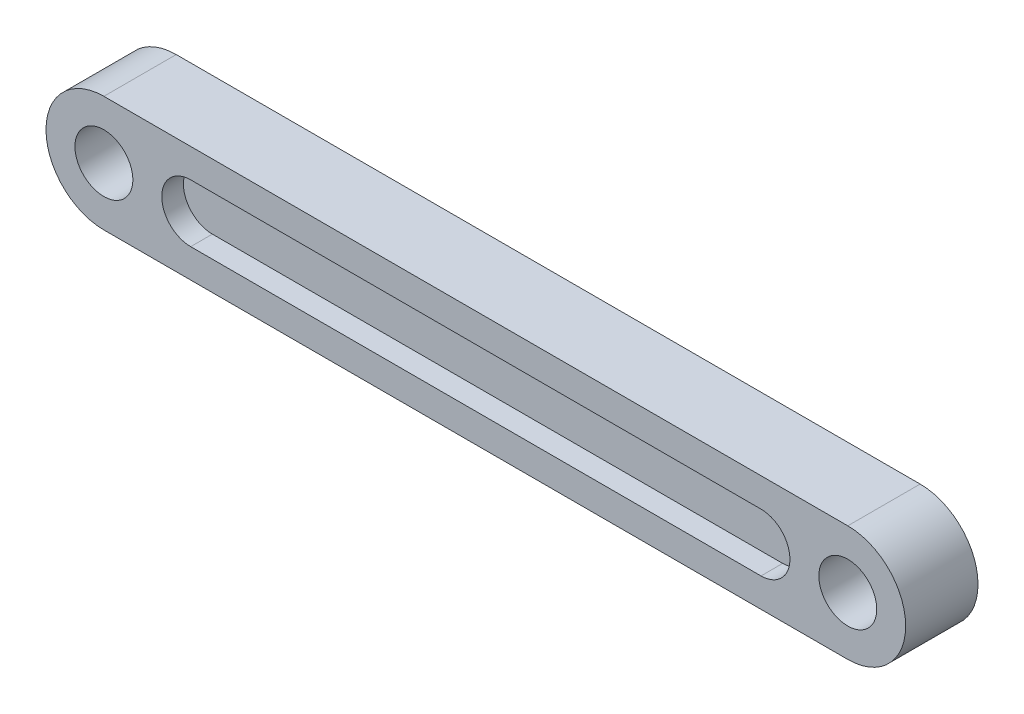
SolidWorks part; units mm, degrees
ref_plane "Front Plane" through (0, 0, 0) normal (0, 0, 1) x (1, 0, 0)
ref_plane "Top Plane" through (0, 0, 0) normal (0, 1, 0) x (1, 0, 0)
ref_plane "Right Plane" through (0, 0, 0) normal (1, 0, 0) x (0, 0, -1)
ref_plane "Plane1" through (0, 0, 0) normal (0, 0, -1) x (-1, 0, 0)
sketch "Sketch1" plane through (0, 0, 0) normal (0, 0, -1) x (-1, 0, 0)
  line L0 (0, 4) -> (-51.4197, 4)
  line L1 (-51.4197, -4) -> (0, -4)
  arc A0 (-51.4197, 4) -> (-51.4197, -4) centre (-51.4197, 0) ccw
  arc A1 (0, -4) -> (0, 4) centre (0, 0) ccw
extrude "Boss-Extrude1" add sketch "Sketch1" against normal blind 5
sketch "Sketch2" plane through (0, 0, 0) normal (0, 0, -1) x (-1, 0, 0)
  line L0 (-6, 2.5) -> (-45.4197, 2.5)
  line L1 (-45.4197, -2.5) -> (-6, -2.5)
  arc A0 (-45.4197, 2.5) -> (-45.4197, -2.5) centre (-45.4197, 0) ccw
  arc A1 (-6, -2.5) -> (-6, 2.5) centre (-6, 0) ccw
extrude "Cut-Extrude1" cut sketch "Sketch2" against normal blind 1.5
sketch "Sketch3" plane through (0, 0, 5) normal (0, 0, 1) x (1, 0, 0)
  line L0 (6, -2) -> (45.4197, -2)
  line L1 (45.4197, 2) -> (6, 2)
  arc A0 (45.4197, -2) -> (45.4197, 2) centre (45.4197, 0) ccw
  arc A1 (6, 2) -> (6, -2) centre (6, 0) ccw
extrude "Cut-Extrude2" cut sketch "Sketch3" against normal blind 1.5
hole_wizard "Ø4.0 (4) Diameter Hole1" positions "Sketch5" profile "Sketch4" hole size "Ø4.0" standard "Ansi Metric"
sketch "Sketch5" plane through (0, 0, 0) normal (0, 0, -1) x (-1, 0, 0)
  point P0 (-51.4197, 0)
  point P1 (0, 0)
sketch "Sketch4" plane through (51.4197, 0, 0) normal (1, 0, 0) x (0, 1, 0)
  line L0 (0, 0) -> (0, 5)
  line L1 (0, 5) -> (2, 5)
  line L2 (2, 5) -> (2, 0)
  line L5 (2, 0) -> (0, 0)
  line L11 (0, -6.35) -> (0, 107.95) construction
  dimension "Thru Hole Dia." = 4
  dimension "Thru Hole Depth" = 5
